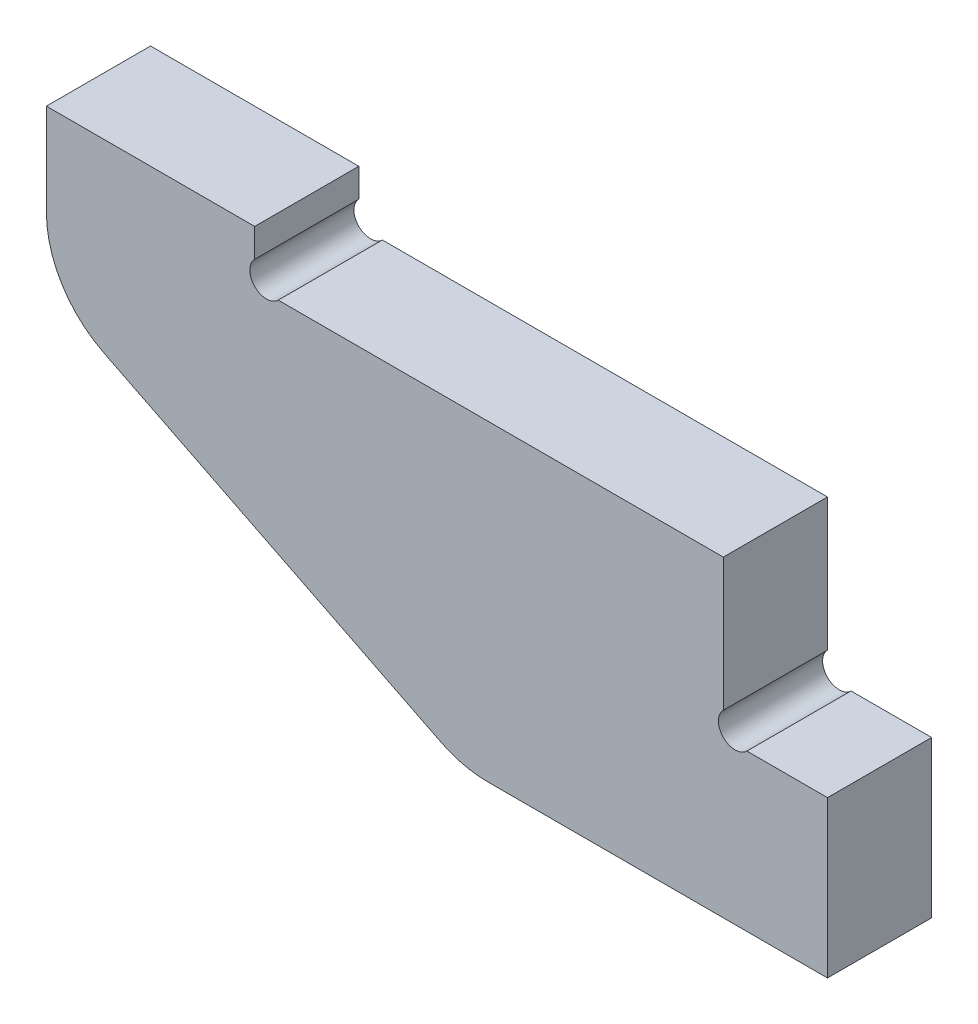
SolidWorks part; units mm, degrees
ref_plane "Plan de face" through (0, 0, 0) normal (0, 0, 1) x (1, 0, 0)
ref_plane "Plan de dessus" through (0, 0, 0) normal (0, 1, 0) x (1, 0, 0)
ref_plane "Plan de droite" through (0, 0, 0) normal (1, 0, 0) x (0, 0, -1)
sketch "Esquisse1" plane through (0, 0, 0) normal (0, 0, 1) x (1, 0, 0)
  line L0 (16.3379, 0) -> (-102.6934, 0) construction
  line L1 (0, -3.2012) -> (0, 61.0425) construction
  line L2 (3.3056, 30) -> (-102.6934, 30) construction
  line L3 (-75, 61.0425) -> (-75, -10.1006) construction
  line L4 (-102.6934, 35) -> (-52.1454, 35) construction
  line L5 (-55, 52.8887) -> (-55, 22.9911) construction
  line L6 (-10, 52.8887) -> (-10, -3.2012) construction
  line L7 (16.3379, 15) -> (-13.6875, 15) construction
  line L8 (-86.6426, 20) -> (-73.4826, 20) construction
  line L9 (-55, 30) -> (-39.9928, 45.0072) construction
  line L10 (-10, 15) -> (6.2117, 31.2117) construction
  line L11 (-35, 3.3149) -> (-35, -10.1006) construction
  line L12 (-52.7373, 30) -> (-10, 30)
  line L13 (-10, 30) -> (-10, 17.2627)
  line L14 (-55, 32.2627) -> (-55, 35)
  line L15 (-55, 35) -> (-75, 35)
  line L16 (-75, 35) -> (-75, 20)
  line L17 (-75, 20) -> (-35, 0)
  line L18 (-35, 0) -> (0, 0)
  line L19 (0, 0) -> (0, 15)
  line L20 (0, 15) -> (-7.7373, 15)
  arc A0 (-10, 17.2627) -> (-7.7373, 15) centre (-8.8686, 16.1314) ccw
  arc A1 (-55, 32.2627) -> (-52.7373, 30) centre (-53.8686, 31.1314) ccw
  dimension "D9" = 20
  dimension "D1" = 30
  dimension "D2" = 75
  dimension "D3" = 5
  dimension "D4" = 20
  dimension "D5" = 15
  dimension "D6" = 10
  dimension "D7" = 45
  dimension "D8" = 45
  dimension "D10" = 40
extrude "Boss.-Extru.1" add sketch "Esquisse1" along normal blind 10
fillet "Congé1" radius 10 2 edges at (-75, 20, 5) (-35, 0, 5)
